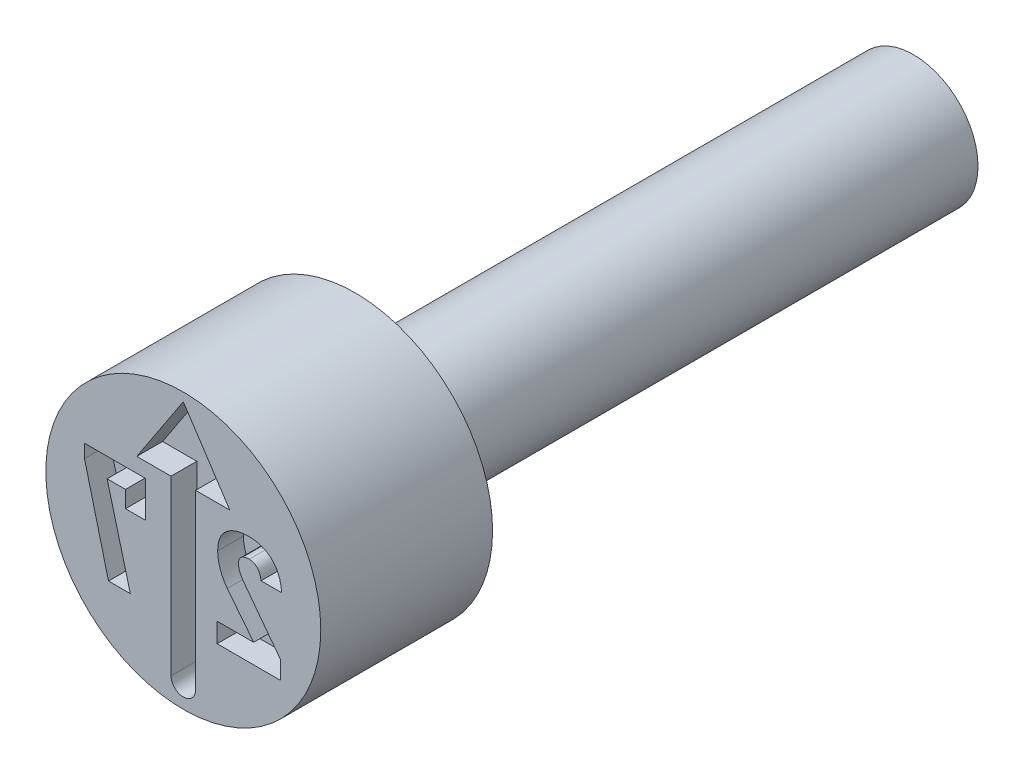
SolidWorks part; units mm, degrees
ref_plane "Front Plane" through (0, 0, 0) normal (0, 0, 1) x (1, 0, 0)
ref_plane "Top Plane" through (0, 0, 0) normal (0, 1, 0) x (1, 0, 0)
ref_plane "Right Plane" through (0, 0, 0) normal (1, 0, 0) x (0, 0, -1)
sketch "Sketch2" plane through (0, 0, 0) normal (1, 0, 0) x (0, 0, -1)
  line L0 (0.4039, 0) -> (50000.4039, 0) construction
  line L6 (0, 3.2) -> (0, 0)
  line L7 (4, 3.2) -> (0, 3.2)
  line L8 (4, 1.5) -> (4, 3.2)
  line L9 (17, 1.5) -> (4, 1.5)
  line L10 (17, 0) -> (17, 1.5)
  line L11 (0, 0) -> (17, 0)
  dimension "D1" = 6.4
  dimension "D2" = 3
  dimension "D3" = 17
  dimension "D4" = 4
revolve "Revolve1" add sketch "Sketch2" angle 360 about L0
sketch "Sketch3" plane through (0, 0, 0) normal (0, 0, 1) x (1, 0, 0)
  line L0 (0, 0) -> (0, 150000) construction
  line L1 (0.2857, 1.3595) -> (0.2857, -2.6642)
  line L2 (1.0829, 1.3595) -> (0.2857, 1.3595)
  line L3 (0, 3.0032) -> (1.0829, 1.3595)
  line L15 (0, 3.0032) -> (-1.0829, 1.3595)
  line L16 (-1.0829, 1.3595) -> (-0.2857, 1.3595)
  line L17 (-0.2857, 1.3595) -> (-0.2857, -2.6642)
  arc A2 (-0.2857, -2.6642) -> (0.2857, -2.6642) centre (0, -2.6642) ccw
extrude "Cut-Extrude4" cut sketch "Sketch3" against normal blind 0.6
sketch "Sketch4" plane through (0, 0, 0) normal (0, 0, 1) x (1, 0, 0)
  text T0 "2  7" font "Bahnschrift" height 2.5
extrude "Cut-Extrude5" cut sketch "Sketch4" against normal blind 0.6
